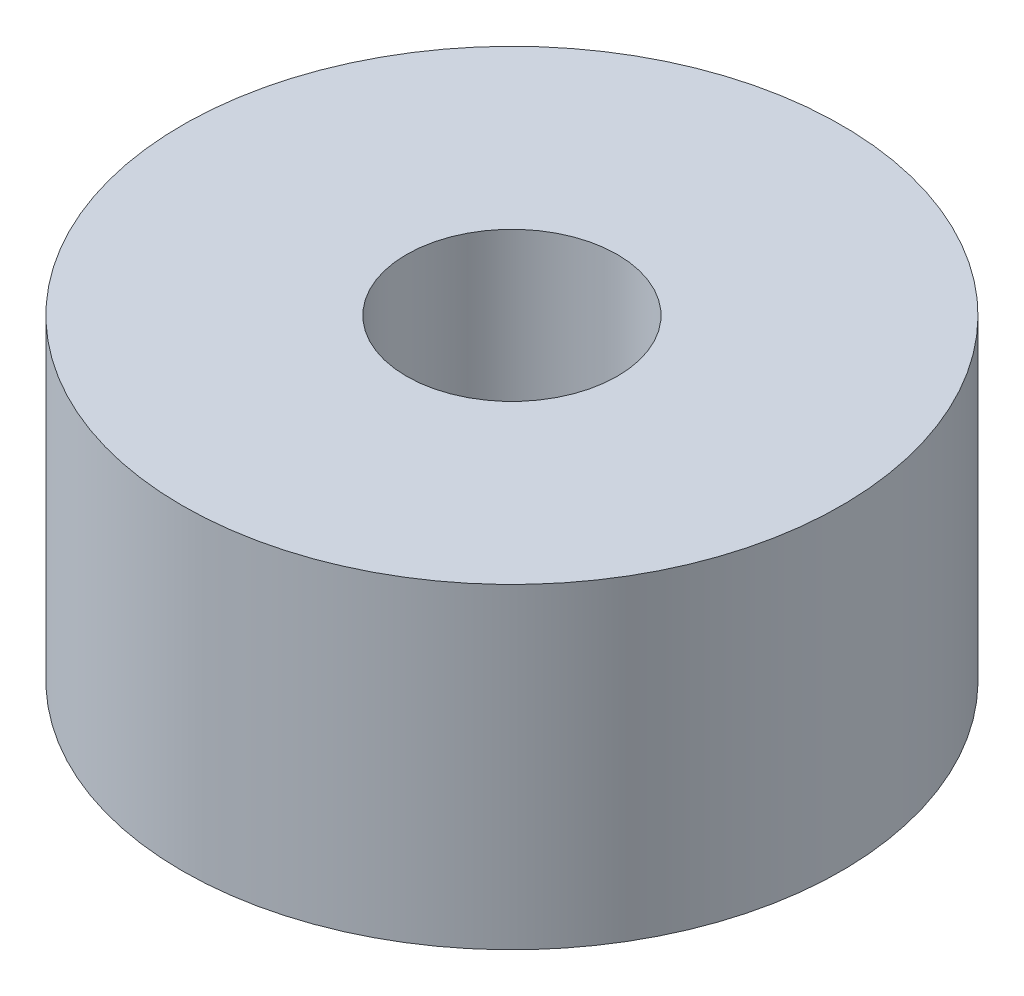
SolidWorks part; units mm, degrees
ref_plane "Płaszczyzna przednia" through (0, 0, 0) normal (0, 0, 1) x (1, 0, 0)
ref_plane "Płaszczyzna górna" through (0, 0, 0) normal (0, 1, 0) x (1, 0, 0)
ref_plane "Płaszczyzna prawa" through (0, 0, 0) normal (1, 0, 0) x (0, 0, -1)
sketch "Szkic1" plane through (0, 0, 0) normal (0, 1, 0) x (1, 0, 0)
  circle A0 centre (0, 0) radius 12.5
  circle A1 centre (0, 0) radius 4
  dimension "D1" = 8
  dimension "D2" = 25
extrude "Dodanie-wyciągnięcie1" add sketch "Szkic1" along normal blind 12
